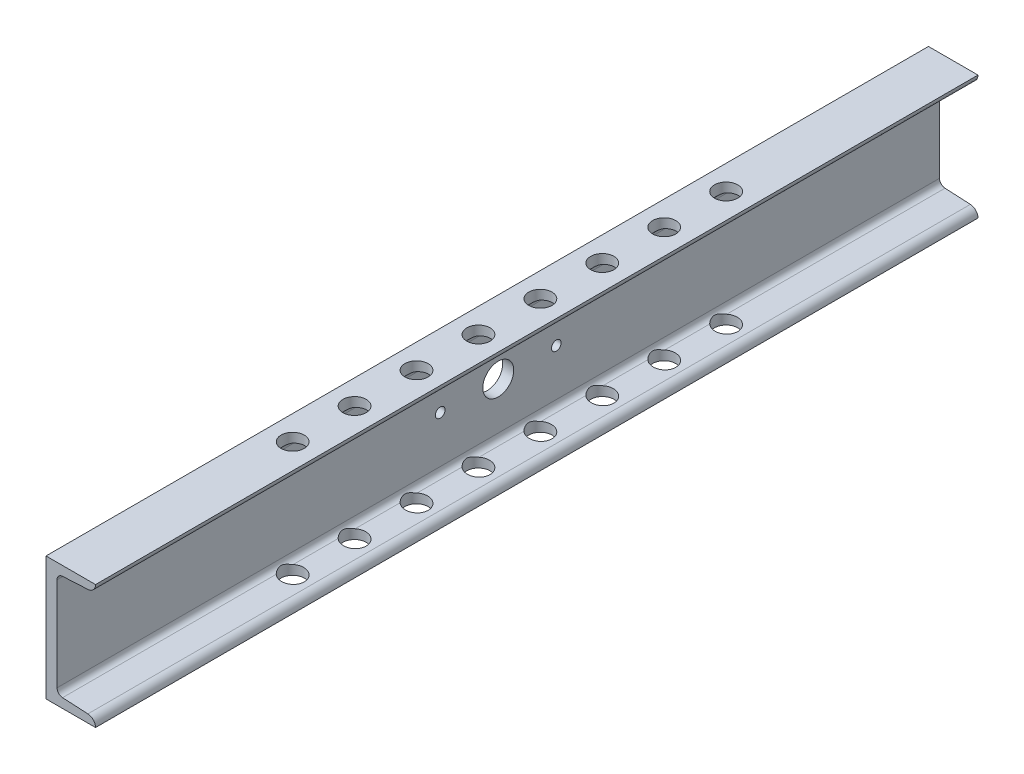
SolidWorks part; units mm, degrees
ref_plane "FRONT" through (0, 0, 0) normal (0, 0, 1) x (1, 0, 0)
ref_plane "TOP" through (0, 0, 0) normal (0, 1, 0) x (1, 0, 0)
ref_plane "RT-SIDE" through (0, 0, 0) normal (1, 0, 0) x (0, 0, -1)
sketch "Sketch1" plane through (0, 0, 0) normal (0, 0, 1) x (1, 0, 0)
  line L0 (40.64, 50.8) -> (0, 50.8)
  line L1 (40.64, -50.8) -> (0, -50.8)
  line L2 (0, 50.8) -> (0, -50.8)
  line L3 (0, 0) -> (-45.5736, 0) construction
  line L12 (9.0424, 38.3576) -> (9.0424, -38.3576)
  line L17 (13.5557, 43.1136) -> (34.3816, 44.2051)
  line L18 (13.5557, -43.1136) -> (34.3816, -44.2051)
  arc A9 (9.0424, -38.3576) -> (13.5557, -43.1136) centre (13.8049, -38.3576) ccw
  arc A10 (9.0424, 38.3576) -> (13.5557, 43.1136) centre (13.8049, 38.3576) cw
  arc A11 (40.64, 50.8) -> (34.3816, 44.2051) centre (34.036, 50.8) cw
  arc A12 (40.64, -50.8) -> (34.3816, -44.2051) centre (34.036, -50.8) ccw
extrude "Base-Extrude" add sketch "Sketch1" along normal mid plane 723.9
ref_plane "Plane1" through (0, 38.1, 0) normal (0, 1, 0) x (-1, 0, 0)
sketch "Sketch2" plane through (0, 50.8, 0) normal (0, 1, 0) x (-1, 0, 0)
  line L0 (0, 0) -> (-40.132, 0) construction
  line L1 (-20.066, 0) -> (-20.066, 239.2473) construction
  circle A0 centre (-20.066, 27.2786) radius 9.525
  circle A1 centre (-20.066, 78.0786) radius 9.525
  circle A2 centre (-20.066, 128.8786) radius 9.525
  circle A3 centre (-20.066, 179.6786) radius 9.525
  circle A4 centre (-20.066, -175.9214) radius 9.525
  circle A5 centre (-20.066, -125.1214) radius 9.525
  circle A6 centre (-20.066, -74.3214) radius 9.525
  circle A7 centre (-20.066, -23.5214) radius 9.525
  point P21 (-20.066, 0)
extrude "Cut-Extrude1" cut sketch "Sketch2" against normal through all
sketch "Sketch3" plane through (0, 0, 0) normal (-1, 0, 0) x (0, 0, 1)
  line L0 (0, 0) -> (0, 43.1136) construction
  line L2 (20.3258, 43.1136) -> (-16.5687, 43.1136) construction
  line L3 (0, 0) -> (-66.2067, 0) construction
  circle A3 centre (-47.625, 0) radius 3.9688
  circle A4 centre (47.625, 0) radius 3.9688
  circle A5 centre (0, 0) radius 12.7
  dimension "D1" = 25.4
  dimension "D2" = 7.9375
  dimension "D3" = 95.25
extrude "Cut-Extrude2" cut sketch "Sketch3" against normal through all
